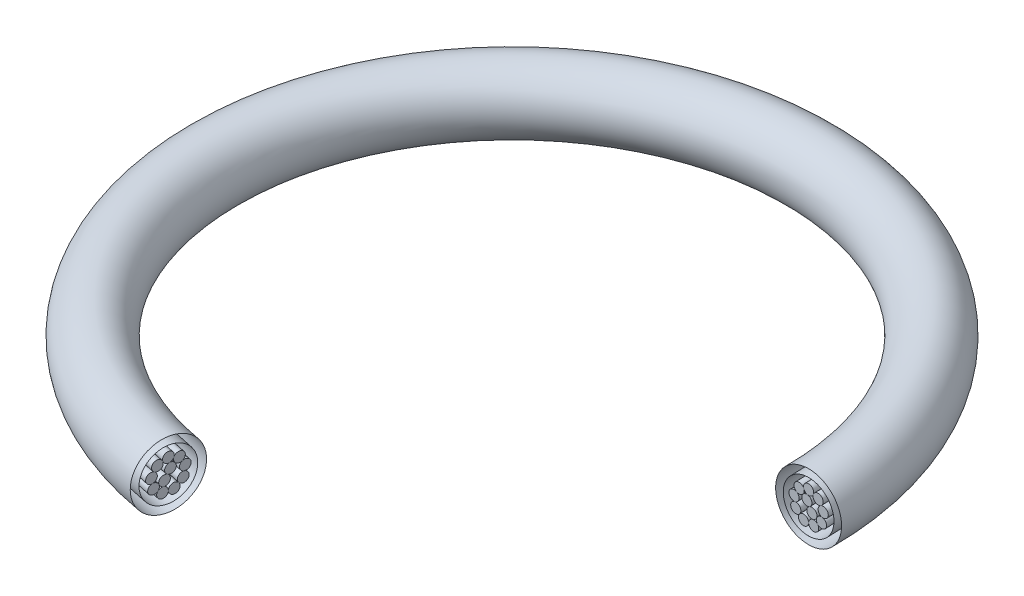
SolidWorks part; units mm, degrees
ref_plane "Front Plane" through (0, 0, 0) normal (0, 0, 1) x (1, 0, 0)
ref_plane "Top Plane" through (0, 0, 0) normal (0, 1, 0) x (1, 0, 0)
ref_plane "Right Plane" through (0, 0, 0) normal (1, 0, 0) x (0, 0, -1)
ref_axis "Axis1" through (0, -55.4402, 0) along (0, 1, 0)
sketch "Sketch1" [suppressed] plane through (0, 0, 0) normal (0, 0, 1) x (1, 0, 0)
  line L0 (0, -1551.6604) -> (0, 76031.3581) construction
  line L1 (0, 0) -> (177.8, 0) construction
  circle A0 centre (198.4375, 0) radius 15.875
  circle A1 centre (198.4375, 0) radius 20.6375
  circle A2 centre (198.4375, 0) radius 3.175
  circle A3 centre (198.4375, 0) radius 6.35 construction
  circle A4 centre (198.4375, 6.35) radius 3.175
  circle A5 centre (203.9368, 3.175) radius 3.175
  circle A6 centre (203.9368, -3.175) radius 3.175
  circle A7 centre (198.4375, -6.35) radius 3.175
  circle A8 centre (192.9382, -3.175) radius 3.175
  circle A9 centre (192.9382, 3.175) radius 3.175
  circle A10 centre (198.4375, 0) radius 10.9985 construction
  circle A11 centre (203.9368, 9.525) radius 3.175
  circle A12 centre (209.436, 0) radius 3.175
  circle A13 centre (203.9368, -9.525) radius 3.175
  circle A14 centre (192.9382, -9.525) radius 3.175
  circle A15 centre (187.439, 0) radius 3.175
  circle A16 centre (192.9382, 9.525) radius 3.175
  circle A17 centre (198.4375, 0) radius 12.7 construction
  circle A18 centre (187.439, 6.35) radius 3.175
  circle A19 centre (198.4375, 12.7) radius 3.175
  circle A20 centre (209.436, 6.35) radius 3.175
  circle A21 centre (209.436, -6.35) radius 3.175
  circle A22 centre (198.4375, -12.7) radius 3.175
  circle A23 centre (187.439, -6.35) radius 3.175
  dimension "D1" = 31.75
  dimension "D2" = 41.275
  dimension "D3" = 6.35
  dimension "D4" = 177.8
revolve "Revolve1" [suppressed] add sketch "Sketch1" angle 360 about L0
sketch "Sketch2" [suppressed] plane through (0, 0, 0) normal (0, 0, 1) x (1, 0, 0)
  line L0 (0, 0) -> (177.8, 0) construction
  line L1 (0, 0) -> (0, -50000) construction
  circle A0 centre (198.4375, 0) radius 15.875
  circle A1 centre (198.4375, 0) radius 20.6375
  dimension "D1" = 41.275
  dimension "D2" = 31.75
  dimension "D3" = 177.8
revolve "Revolve2" [suppressed] add sketch "Sketch2" angle 360 about L1
sketch "Sketch4" [suppressed] plane through (0, 0, 0) normal (0, 0, 1) x (1, 0, 0)
  line L0 (0, 0) -> (172.339, 0) construction
  line L1 (0, -55.4402) -> (0, 41.5764) construction
  line L2 (203.6563, 0) -> (204.089, 0) construction
  circle A0 centre (188.214, 0) radius 15.875 construction
  circle A1 centre (188.214, 0) radius 12.2673 construction
  circle A2 centre (177.5902, -6.1336) radius 3.175
  circle A3 centre (175.9467, 0) radius 3.175 construction
  circle A4 centre (177.5902, 6.1336) radius 3.175
  circle A5 centre (182.0804, 10.6238) radius 3.175
  circle A6 centre (188.214, 12.2673) radius 3.175
  circle A7 centre (194.3476, 10.6238) radius 3.175
  circle A8 centre (198.8378, 6.1336) radius 3.175
  circle A9 centre (200.4813, 0) radius 3.175 construction
  circle A10 centre (198.8378, -6.1336) radius 3.175
  circle A11 centre (194.3476, -10.6238) radius 3.175
  circle A12 centre (188.214, -12.2673) radius 3.175
  circle A13 centre (182.0804, -10.6238) radius 3.175
  circle A14 centre (188.214, 0) radius 6.35 construction
  circle A15 centre (182.0804, -1.6435) radius 3.175 construction
  circle A17 centre (183.7239, 4.4901) radius 3.175 construction
  circle A18 centre (189.8575, 6.1336) radius 3.175 construction
  circle A19 centre (194.3476, 1.6435) radius 3.175 construction
  circle A20 centre (192.7041, -4.4901) radius 3.175 construction
  circle A22 centre (186.5705, -6.1336) radius 3.175 construction
  circle A23 centre (188.214, 0) radius 3.175 construction
  dimension "D2" = 31.75
  dimension "D3" = 6.35
  dimension "D1" = 188.214
sketch "Sketch3" [suppressed] plane through (0, 0, 0) normal (0, 0, 1) x (1, 0, 0)
  line L0 (0, -1000) -> (0, 49000) construction
  line L1 (0, 0) -> (167.64, 0) construction
  circle A0 centre (188.2775, 0) radius 20.6375
  circle A1 centre (188.2775, 0) radius 15.875
  dimension "D2" = 41.275
  dimension "D3" = 31.75
  dimension "D1" = 167.64
revolve "Revolve-Thin1" [suppressed] add sketch "Sketch3" angle 360 about L0
revolve "Revolve3" [suppressed] add sketch "Sketch4" angle 360 about axis through (0, -55.4402, 0) along (0, 1, 0)
sketch "Sketch5" plane through (0, 0, 0) normal (0, 0, 1) x (1, 0, 0)
  line L0 (165.1, 0) -> (0, 0) construction
  line L1 (141.9062, 60.0856) -> (178.7592, -41.1673) construction
  line L2 (165.1, 35.336) -> (165.1, -45.1279) construction
  line L3 (149.4633, 88.6802) -> (180.7367, -88.6802) construction
  circle A0 centre (185.7375, 0) radius 20.6375 construction
  circle A1 centre (185.7375, 0) radius 9.2831 construction
  circle A3 centre (185.7375, 9.2831) radius 3.175
  circle A4 centre (191.7045, 7.1113) radius 3.175
  circle A5 centre (194.8795, 1.612) radius 3.175
  circle A6 centre (193.7769, -4.6415) radius 3.175
  circle A10 centre (185.7375, 0) radius 15.875 construction
  circle A11 centre (188.9125, -8.7232) radius 3.175
  circle A12 centre (182.5625, -8.7232) radius 3.175
  circle A14 centre (177.6981, -4.6415) radius 3.175
  circle A15 centre (176.5955, 1.612) radius 3.175
  circle A16 centre (179.7705, 7.1113) radius 3.175
  circle A17 centre (185.7375, 0) radius 3.224 construction
  circle A18 centre (184.6348, 3.0295) radius 3.175
  circle A19 centre (187.8098, -2.4697) radius 3.175
  dimension "D1" = 41.275
  dimension "D2" = 6.35
  dimension "D3" = 31.75
  dimension "D4" = 165.1
  dimension "D5" = 20
  dimension "D6" = 10
revolve "Revolve4" add sketch "Sketch5" angle 260 about axis through (0, -55.4402, 0) along (0, 1, 0)
sketch "Sketch6" plane through (0, 0, 0) normal (0, 0, 1) x (1, 0, 0)
  line L0 (134.7122, 21.8395) -> (200.8101, -44.2584) construction
  line L1 (165.1, 35.336) -> (165.1, -45.1279) construction
  circle A0 centre (185.7375, 0) radius 15.875
  circle A1 centre (185.7375, 0) radius 20.6375
  circle A2 centre (185.7375, 0) radius 15.875 construction
  circle A3 centre (185.7375, 0) radius 20.6375 construction
  dimension "D1" = 45
revolve "Revolve-Thin2" add sketch "Sketch6" angle 260 about axis through (0, -55.4402, 0) along (0, 1, 0)
ref_plane "Plane1" through (144.6174, 52.6364, 0) normal (-0.9397, -0.342, 0) x (0.342, -0.9397, 0)
ref_plane "Plane2" through (78.2758, 78.2758, 0) normal (-0.7071, -0.7071, 0) x (0.7071, -0.7071, 0)
ref_plane "Plane3" through (160.1216, 28.2338, 0) normal (-0.9848, -0.1736, 0) x (0.1736, -0.9848, 0)
sketch "Sketch7" plane through (0, 0, 0) normal (0, 1, 0) x (1, 0, 0)
  circle A0 centre (0, 0) radius 185.7375
ref_plane "Plane4" through (0, 0, 0) normal (0.9848, 0, 0.1736) x (0.1736, 0, -0.9848)
ref_plane "Plane5" through (0, 0, 0) normal (0.766, 0, -0.6428) x (-0.6428, 0, -0.766)
